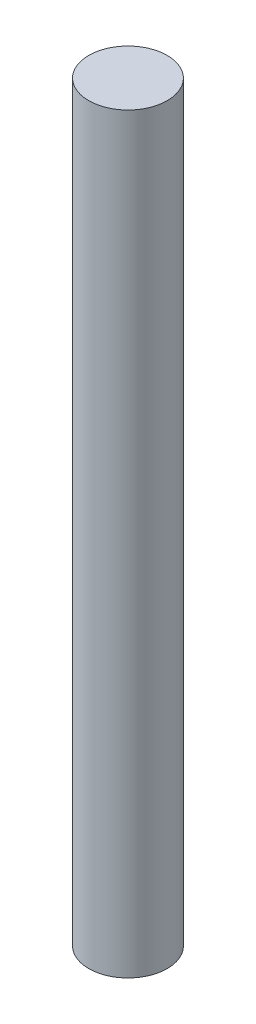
SolidWorks part; units mm, degrees
ref_plane "Front Plane" through (0, 0, 0) normal (0, 0, 1) x (1, 0, 0)
ref_plane "Top Plane" through (0, 0, 0) normal (0, 1, 0) x (1, 0, 0)
ref_plane "Right Plane" through (0, 0, 0) normal (1, 0, 0) x (0, 0, -1)
sketch "Sketch1" plane through (0, 0, 0) normal (0, 1, 0) x (1, 0, 0)
  circle A0 centre (0, 0) radius 2.6095
  dimension "D1" = 5.219
extrude "Boss-Extrude1" add sketch "Sketch1" along normal blind 50
